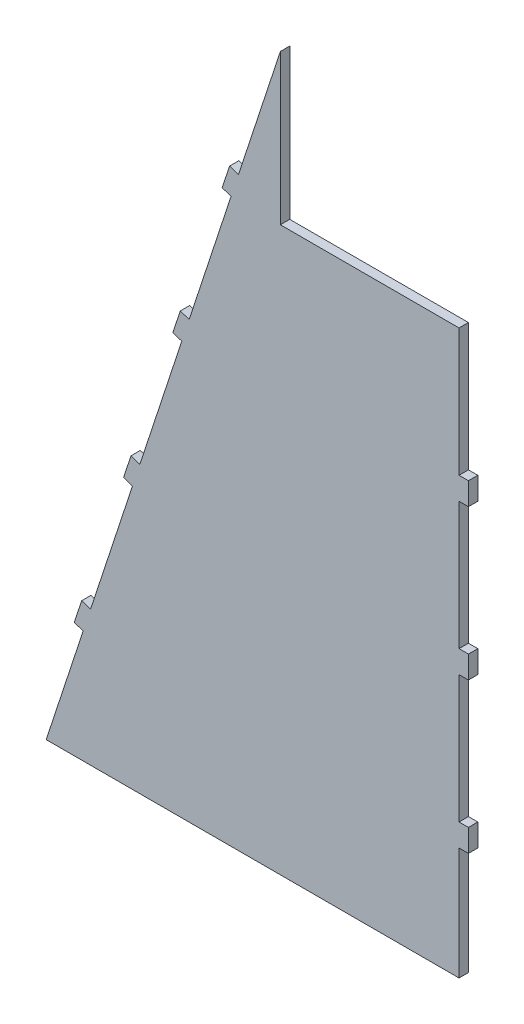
SolidWorks part; units mm, degrees
ref_plane "前视基准面" through (0, 0, 0) normal (0, 0, 1) x (1, 0, 0)
ref_plane "上视基准面" through (0, 0, 0) normal (0, 1, 0) x (1, 0, 0)
ref_plane "右视基准面" through (0, 0, 0) normal (1, 0, 0) x (0, 0, -1)
sketch "草图1" plane through (0, 0, 0) normal (0, 0, 1) x (1, 0, 0)
  line L0 (34.319, 24.0902) -> (36.819, 24.0902)
  line L5 (34.319, -15.9098) -> (36.819, -15.9098)
  line L7 (34.319, -21.9098) -> (36.819, -21.9098)
  line L8 (36.819, -15.9098) -> (36.819, -21.9098)
  line L9 (34.319, 18.0902) -> (36.819, 18.0902)
  line L10 (36.819, 24.0902) -> (36.819, 18.0902)
  line L11 (34.319, 64.0902) -> (36.819, 64.0902)
  line L13 (34.319, 98.0902) -> (34.319, 64.0902)
  line L14 (34.319, -51.9098) -> (-75.681, -51.9098)
  line L16 (34.319, 58.0902) -> (36.819, 58.0902)
  line L17 (36.819, 64.0902) -> (36.819, 58.0902)
  line L18 (34.319, 58.0902) -> (34.319, 24.0902)
  line L19 (34.319, 18.0902) -> (34.319, -15.9098)
  line L20 (34.319, -21.9098) -> (34.319, -51.9098)
  line L21 (-13.2855, 138.0902) -> (-24.4515, 104.0886)
  line L22 (-75.681, -51.9098) -> (-86.4654, -51.9098)
  line L23 (-39.5573, 58.0902) -> (-50.7228, 24.0902)
  line L24 (-52.6932, 18.0902) -> (-63.8587, -15.9098)
  line L25 (-65.8291, -21.9098) -> (-75.681, -51.9098)
  line L26 (34.319, 98.0902) -> (-13.2855, 98.0902)
  line L27 (-13.2855, 98.0902) -> (-13.2855, 138.0902)
  line L28 (-26.4219, 98.0886) -> (-28.7971, 98.8687)
  line L29 (-65.8291, -21.9098) -> (-68.2043, -21.1297)
  line L30 (-68.2043, -21.1297) -> (-66.2339, -15.1297)
  line L31 (-66.2339, -15.1297) -> (-63.8587, -15.9098)
  line L32 (-52.6932, 18.0902) -> (-55.0684, 18.8703)
  line L33 (-55.0684, 18.8703) -> (-53.098, 24.8703)
  line L34 (-53.098, 24.8703) -> (-50.7228, 24.0902)
  line L35 (-39.5573, 58.0902) -> (-41.9325, 58.8703)
  line L36 (-41.9325, 58.8703) -> (-39.9621, 64.8703)
  line L37 (-39.9621, 64.8703) -> (-37.5869, 64.0902)
  line L38 (-28.7971, 98.8687) -> (-26.8267, 104.8687)
  line L39 (-26.8267, 104.8687) -> (-24.4515, 104.0886)
  line L40 (-26.4219, 98.0886) -> (-37.5869, 64.0902)
  point P9 (35.569, -21.9098)
  point P18 (-13.2855, 138.0902)
  point P21 (-13.2855, 138.0902)
  dimension "D7" = 199.983
  dimension "D1" = 2.5
  dimension "D2" = 110
  dimension "D4" = 42.1017
  dimension "D5" = 3
  dimension "D3" = 30
  dimension "D6" = 40
  dimension "D8" = 2.5
  dimension "D9" = 6.3153
  dimension "D10" = 6.3153
  dimension "D11" = 6.3153
  dimension "D12" = 40
  dimension "D13" = 2
extrude "凸台-拉伸1" add sketch "草图1" along normal blind 2.5
